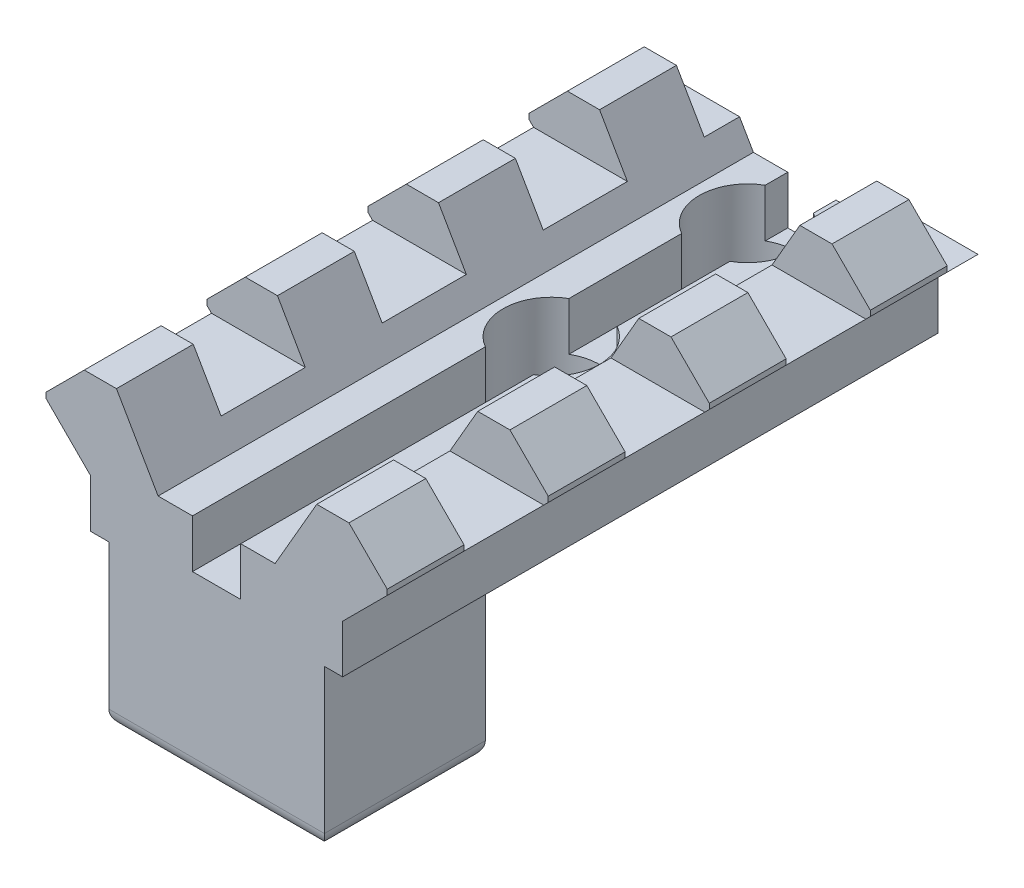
SolidWorks part; units mm, degrees
ref_plane "Front Plane" through (0, 0, 0) normal (0, 0, 1) x (1, 0, 0)
ref_plane "Top Plane" through (0, 0, 0) normal (0, 1, 0) x (1, 0, 0)
ref_plane "Right Plane" through (0, 0, 0) normal (1, 0, 0) x (0, 0, -1)
sketch "Sketch1" plane through (0, 0, 0) normal (0, 1, 0) x (1, 0, 0)
  line L0 (-3.5, 27.0928) -> (3.5, 27.0928)
  line L1 (3.5, 27.0928) -> (3.5, 0.0928)
  line L2 (3.5, 0.0928) -> (6.7, 0.0928)
  line L3 (6.7, 0.0928) -> (6.7, -9.9072)
  line L4 (6.7, -9.9072) -> (-6.7, -9.9072)
  line L5 (-6.7, -9.9072) -> (-6.7, 0.0928)
  line L6 (-6.7, 0.0928) -> (-3.5, 0.0928)
  line L7 (-3.5, 0.0928) -> (-3.5, 27.0928)
  line L8 (0, 24.593) -> (0, 9.393) construction
  circle A0 centre (0, 23.0928) radius 1.5003
  circle A1 centre (0, 10.8933) radius 1.5003
  point P7 (0, 27.0928)
  point P9 (0, -9.9072)
  dimension "D5" = 3.0005
  dimension "D1" = 7
  dimension "D2" = 13.4
  dimension "D3" = 10
  dimension "D4" = 37
  dimension "D6" = 4
  dimension "D7" = 15.2
extrude "Boss-Extrude1" add sketch "Sketch1" along normal blind 5
sketch "Sketch2" plane through (0, 5, 0) normal (0, 1, 0) x (1, 0, 0)
  circle A0 centre (0, 10.8933) radius 3
  circle A1 centre (0, 23.0928) radius 3
  circle A2 centre (0, 23.0928) radius 1.5003 construction
  circle A3 centre (0, 10.8933) radius 1.5003 construction
  dimension "D1" = 6
extrude "Cut-Extrude1" cut sketch "Sketch2" against normal blind 3
sketch "Sketch3" plane through (0, 0, 0) normal (0, -1, 0) x (1, 0, 0)
  line L1 (6.7, 9.9072) -> (-6.7, 9.9072)
  line L2 (6.7, 9.9072) -> (6.7, -0.0928)
  line L3 (6.7, -0.0928) -> (-6.7, -0.0928)
  line L4 (-6.7, 9.9072) -> (-6.7, -0.0928)
extrude "Boss-Extrude2" add sketch "Sketch3" along normal blind 5
sketch "Sketch4" plane through (0, 0, 9.9072) normal (0, 0, 1) x (1, 0, 0)
  line L0 (-7.8359, 5) -> (7.8359, 5)
  line L1 (7.8359, 5) -> (7.8359, 8)
  line L2 (7.8359, 8) -> (10.7738, 10.9379)
  line L3 (10.7738, 10.9379) -> (8.2254, 13.4864)
  line L4 (8.2254, 13.4864) -> (-8.2254, 13.4864)
  line L5 (-8.2254, 13.4864) -> (-10.7738, 10.9379)
  line L6 (-10.7738, 10.9379) -> (-7.8359, 8)
  line L7 (-7.8359, 8) -> (-7.8359, 5)
  line L8 (-10.6045, 11.1073) -> (-10.6045, 10.7686)
  line L9 (-6.7, 5) -> (6.7, 5) construction
  line L10 (0, 13.4864) -> (0, 5) construction
  line L11 (-10.7738, 10.9379) -> (0, 10.9379) construction
  line L12 (0, 10.9379) -> (10.7738, 10.9379) construction
  line L13 (10.6045, 11.1073) -> (10.6045, 10.7686)
  line L14 (-10.6045, 10.7686) -> (10.6045, 10.7686) construction
  line L15 (-10.6045, 11.1073) -> (10.6045, 11.1073) construction
  point P6 (0, 5)
  point P11 (0, 5)
  point P12 (0, 13.4864)
  point P13 (-9.4996, 12.2122)
  point P14 (-9.3049, 9.469)
  point P17 (9.4996, 12.2122)
  point P23 (0, 11.1073)
  point P24 (0, 0)
  point P25 (0, 0)
  point P26 (10.6045, 15.6473)
  point P27 (0, 0)
  point P28 (9.4021, 14.1194)
  dimension "D1" = 2.7432
  dimension "D2" = 15.6718
  dimension "D3" = 45
  dimension "D4" = 45
  dimension "D5" = 18.9992
  dimension "D6" = 21.209
  dimension "D7" = 3
extrude "Boss-Extrude3" add sketch "Sketch4" against normal up to surface (37 mm away) contours L13 L3 L4 L5 L8 L6 L7 L0 L1 L2 M16
sketch "Sketch5" plane through (10.6045, 0, 0) normal (1, 0, 0) x (0, 0, -1)
  line L0 (27.0928, 13.4864) -> (-9.9072, 13.4864) construction
  line L1 (-5.132, 13.4864) -> (0.1004, 13.4864)
  line L2 (-5.132, 13.4864) -> (-5.132, 10.4892)
  line L3 (-5.132, 10.4892) -> (0.1004, 10.4892)
  line L4 (0.1004, 13.4864) -> (0.1004, 10.4892)
  line L5 (4.878, 13.4864) -> (4.878, 10.4892)
  line L6 (4.878, 13.4864) -> (10.1104, 13.4864)
  line L7 (10.1104, 13.4864) -> (10.1104, 10.4892)
  line L8 (4.878, 10.4892) -> (10.1104, 10.4892)
  line L9 (14.888, 13.4864) -> (14.888, 10.4892)
  line L10 (14.888, 13.4864) -> (20.1204, 13.4864)
  line L11 (20.1204, 13.4864) -> (20.1204, 10.4892)
  line L12 (14.888, 10.4892) -> (20.1204, 10.4892)
  line L13 (24.898, 13.4864) -> (24.898, 10.4892)
  line L14 (24.898, 13.4864) -> (30.1304, 13.4864)
  line L15 (30.1304, 13.4864) -> (30.1304, 10.4892)
  line L16 (24.898, 10.4892) -> (30.1304, 10.4892)
  dimension "D1" = 10.0076
  dimension "D2" = 5.2324
  dimension "D3" = 2.9972
  dimension "D4" = 4
extrude "Cut-Extrude2" cut sketch "Sketch5" against normal through all
sketch "Sketch6" plane through (0, 13.4864, 0) normal (0, 1, 0) x (1, 0, 0)
  circle A0 centre (0, 23.0928) radius 3
  circle A1 centre (0, 10.8933) radius 3
  circle A2 centre (0, 23.0928) radius 3 construction
  circle A3 centre (0, 10.8933) radius 3 construction
extrude "Cut-Extrude3" cut sketch "Sketch6" against normal up to surface (8.4864 mm away)
sketch "Sketch7" plane through (0, 0, 9.9072) normal (0, 0, 1) x (1, 0, 0)
  line L0 (6.7, 5) -> (7.8359, 5) construction
  line L2 (-1.5, 6) -> (1.5, 6)
  line L3 (1.5, 6) -> (1.5, 9)
  line L4 (-1.5, 6) -> (-1.5, 9)
  line L5 (1.5, 9) -> (3.6351, 9)
  line L6 (3.6351, 9) -> (6.2254, 13.4864)
  line L7 (8.2254, 13.4864) -> (-8.2254, 13.4864) construction
  line L8 (6.2254, 13.4864) -> (-6.2254, 13.4864)
  line L9 (-6.2254, 13.4864) -> (-3.6351, 9)
  line L10 (-3.6351, 9) -> (-1.5, 9)
  point P2 (4.3025, 9)
  point P4 (7.268, 5)
  point P5 (0, 0)
  point P9 (0, 6)
  point P12 (0, 13.4864)
  dimension "D1" = 4
  dimension "D2" = 3
  dimension "D3" = 60
  dimension "D4" = 2
extrude "Cut-Extrude4" cut sketch "Sketch7" against normal through all
fillet "Fillet1" radius 1 4 edges at (0, -5, -0.0928) (-6.7, -5, 4.9072) (0, -5, 9.9072) (6.7, -5, 4.9072)
sketch "Sketch8" plane through (3.5, 0, 0) normal (1, 0, 0) x (0, 0, -1)
  line L0 (27.0928, 5) -> (27.0928, 0) construction
  line L1 (27.0928, 1) -> (0.0928, 1)
  line L2 (27.0928, 1) -> (27.0928, 0)
  line L3 (27.0928, 0) -> (0.0928, 0)
  line L4 (0.0928, 1) -> (0.0928, 0)
  line L5 (0.0928, 0) -> (27.0928, 0) construction
  line L6 (0.0928, 5) -> (0.0928, 0) construction
  point P8 (0, 0)
  dimension "D2" = 1
extrude "Cut-Extrude6" cut sketch "Sketch8" against normal through all
